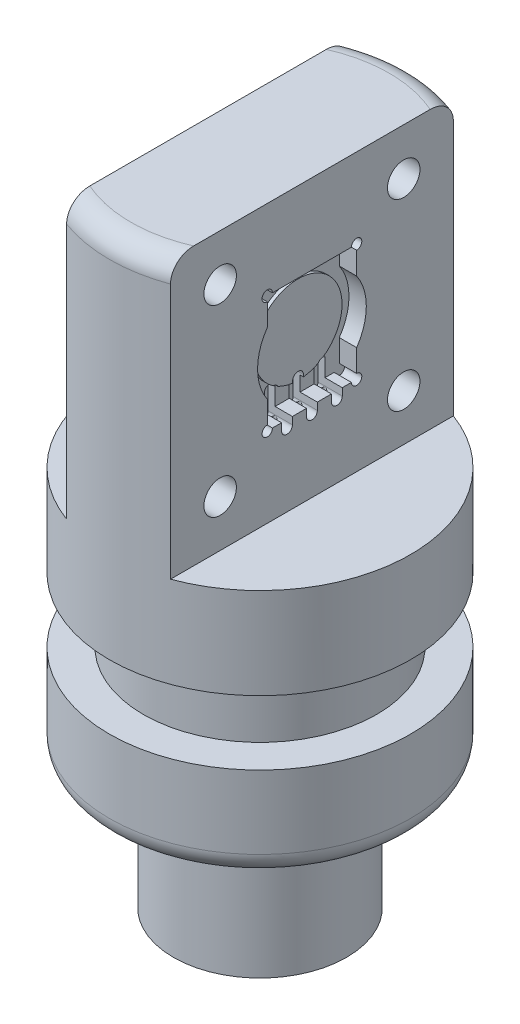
SolidWorks part; units mm, degrees
ref_plane "Front Plane" through (0, 0, 0) normal (0, 0, 1) x (1, 0, 0)
ref_plane "Top Plane" through (0, 0, 0) normal (0, 1, 0) x (1, 0, 0)
ref_plane "Right Plane" through (0, 0, 0) normal (1, 0, 0) x (0, 0, -1)
sketch "Sketch1" plane through (0, 0, 0) normal (0, 0, 1) x (1, 0, 0)
  line L0 (0, 0) -> (0, -33.5067) construction
  line L1 (0, 0) -> (0, 24.13)
  line L2 (0, 24.13) -> (5.5245, 24.13)
  line L3 (5.5245, 24.13) -> (5.5245, 10.6299)
  line L4 (4.7117, 4.7752) -> (2.6162, 4.7752)
  line L5 (2.6162, 4.7752) -> (2.6162, 3.8862)
  line L6 (2.6162, 3.8862) -> (3.175, 3.8862)
  line L7 (3.175, 3.8862) -> (3.175, 0)
  line L8 (3.175, 0) -> (0, 0)
  line L9 (5.5245, 8.2677) -> (5.5245, 5.588)
  line L10 (5.5245, 8.2677) -> (4.2799, 8.2677)
  line L12 (5.5245, 10.6299) -> (4.2799, 10.6299)
  line L13 (4.2799, 8.2677) -> (4.2799, 10.6299)
  arc A0 (5.5245, 5.588) -> (4.7117, 4.7752) centre (4.7117, 5.588) cw
  dimension "D10" = 0.8128
  dimension "D1" = 5.2324
  dimension "D2" = 6.35
  dimension "D3" = 11.049
  dimension "D4" = 4.7752
  dimension "D5" = 0.889
  dimension "D6" = 24.13
  dimension "D7" = 8.5598
  dimension "D8" = 2.3622
  dimension "D9" = 3.4925
revolve "Revolve1" add sketch "Sketch1" angle 360 about L0
fillet "Fillet1" radius 0.7874 1 edges at (0, 24.13, 5.5245)
sketch "Sketch2" plane through (0, 0, 0) normal (0, 0, 1) x (1, 0, 0)
  line L0 (5.5245, 24.13) -> (-5.5245, 24.13) construction
  line L2 (6.6159, 24.13) -> (6.6159, 13.97)
  line L3 (1.905, 24.13) -> (1.905, 13.97)
  line L4 (1.905, 13.97) -> (6.6159, 13.97)
  line L5 (1.905, 24.13) -> (6.6159, 24.13)
  dimension "D1" = 10.16
  dimension "D3" = 1.905
extrude "Flat for chip" cut sketch "Sketch2" against normal through all and the other way through all
mirror "Mirrored flat" about plane through (0, 0, 0) normal (1, 0, 0) of "Flat for chip"
sketch "Sketch3" plane through (1.905, 0, 0) normal (1, 0, 0) x (0, 0, -1)
  line L0 (-1.6383, 19.05) -> (-3.2391, 19.05) construction
  line L1 (1.6383, 21.1963) -> (-1.6383, 21.1963)
  line L2 (1.6383, 21.1963) -> (1.6383, 16.9037)
  line L3 (1.6383, 16.9037) -> (-1.6383, 16.9037)
  line L4 (-1.6383, 21.1963) -> (-1.6383, 16.9037)
  line L6 (0, 16.9037) -> (0, 0) construction
  line L9 (-1.6383, 21.1963) -> (-1.6383, 24.13) construction
  line L10 (4.3372, 24.13) -> (-4.3372, 24.13) construction
  line L11 (-1.6383, 16.9037) -> (-1.6383, 13.97) construction
  line L12 (5.1857, 13.97) -> (-5.1857, 13.97) construction
  dimension "D1" = 4.2926
  dimension "D2" = 3.2766
extrude "Chip Pocket" cut sketch "Sketch3" against normal blind 0.508
sketch "Sketch6" plane through (1.905, 0, 0) normal (1, 0, 0) x (0, 0, -1)
  circle A0 centre (-1.6383, 16.9037) radius 0.1905
  circle A1 centre (-1.6383, 21.1963) radius 0.1905
  circle A2 centre (1.6383, 21.1963) radius 0.1905
  circle A3 centre (1.6383, 16.9037) radius 0.1905
  dimension "D1" = 0.381
extrude "Corner Holes" cut sketch "Sketch6" against normal blind 0.635
sketch "Sketch5" plane through (1.905, 0, 0) normal (1, 0, 0) x (0, 0, -1)
  line L0 (-1.6383, 16.9037) -> (1.6383, 21.1963) construction
  line L2 (-1.4478, 16.9037) -> (1.4478, 16.9037) construction
  line L5 (-1.6383, 21.1963) -> (-1.6383, 20.1865)
  line L6 (-1.6383, 16.9037) -> (1.6383, 16.9037)
  line L7 (1.6383, 16.9037) -> (1.6383, 17.9135)
  line L8 (1.6383, 21.1963) -> (-1.6383, 21.1963)
  line L9 (1.6383, 20.1865) -> (1.6383, 21.1963)
  line L10 (-1.6383, 17.9135) -> (-1.6383, 16.9037)
  line L11 (1.4478, 21.1963) -> (-1.4478, 21.1963) construction
  circle A0 centre (0, 19.05) radius 1.6129
  arc A1 (-1.6383, 20.1865) -> (-1.6383, 17.9135) centre (0, 19.05) ccw
  arc A6 (1.6383, 17.9135) -> (1.6383, 20.1865) centre (0, 19.05) ccw
  dimension "D2" = 3.2258
  dimension "D3" = 0.381
extrude "Pedestal" cut sketch "Sketch5" against normal blind 0.635
sketch "Sketch7" plane through (1.905, 0, 0) normal (1, 0, 0) x (0, 0, -1)
  line L0 (-0.9144, 16.637) -> (-0.9144, 17.526) construction
  line L1 (-1.1125, 16.637) -> (-1.1125, 17.526)
  line L2 (-0.7163, 16.637) -> (-0.7163, 17.526)
  line L3 (0, 16.637) -> (0, 17.526) construction
  line L4 (-0.1981, 16.637) -> (-0.1981, 17.526)
  line L5 (0.1981, 16.637) -> (0.1981, 17.526)
  line L6 (0.9144, 16.637) -> (0.9144, 17.526) construction
  line L7 (0.7163, 16.637) -> (0.7163, 17.526)
  line L8 (1.1125, 16.637) -> (1.1125, 17.526)
  line L9 (0, 16.637) -> (0.9144, 16.637) construction
  line L10 (1.6383, 21.1963) -> (-1.6383, 16.9037) construction
  line L11 (-0.9144, 16.637) -> (0, 16.637) construction
  line L13 (1.1833, 19.05) -> (0, 19.05) construction
  line L15 (0, 19.05) -> (0, 21.1963) construction
  line L16 (1.4478, 21.1963) -> (-1.4478, 21.1963) construction
  arc A0 (-1.1125, 16.637) -> (-0.7163, 16.637) centre (-0.9144, 16.637) ccw
  arc A1 (-0.7163, 17.526) -> (-1.1125, 17.526) centre (-0.9144, 17.526) ccw
  arc A2 (-0.1981, 16.637) -> (0.1981, 16.637) centre (0, 16.637) ccw
  arc A3 (0.1981, 17.526) -> (-0.1981, 17.526) centre (0, 17.526) ccw
  arc A4 (0.7163, 16.637) -> (1.1125, 16.637) centre (0.9144, 16.637) ccw
  arc A5 (1.1125, 17.526) -> (0.7163, 17.526) centre (0.9144, 17.526) ccw
  circle A7 centre (-1.6383, 16.9037) radius 0.1905 construction
  point P2 (-0.9144, 17.0815)
  point P7 (0, 17.0815)
  point P14 (0.9144, 17.0815)
  dimension "D4" = 2.413
  dimension "D1" = 0.9144
  dimension "D2" = 0.3962
  dimension "D3" = 1.524
extrude "Slots" cut sketch "Sketch7" against normal blind 0.889
ref_plane "Plane1" through (5.6556, 15.5386, 0) normal (0.342, 0.9397, 0) x (0, 0, -1)
sketch "Sketch8" plane through (5.6556, 15.5386, 0) normal (0.342, 0.9397, 0) x (0, 0, -1)
  line L0 (-0.9144, 3.8323) -> (-0.9144, 4.4696) construction
  line L1 (0, 4.4696) -> (0, 3.8323) construction
  line L2 (0.9144, 4.4696) -> (0.9144, 3.8323) construction
  line L8 (0.9144, 4.4696) -> (0.9144, 4.6677) construction
  circle A0 centre (0, 4.4696) radius 0.1981
  circle A1 centre (0.9144, 4.4696) radius 0.1981
  circle A2 centre (-0.9144, 4.4696) radius 0.1981
  ellipse E0 centre (-0.9144, 3.9001) end of major axis (-1.1125, 3.9001) minor radius 0.0678 (-1.1125, 3.9001) -> (-0.7163, 3.9001) ccw construction
  ellipse E1 centre (0, 3.9001) end of major axis (-0.1981, 3.9001) minor radius 0.0678 (-0.1981, 3.9001) -> (0.1981, 3.9001) ccw construction
  ellipse E2 centre (0.9144, 3.9001) end of major axis (0.7163, 3.9001) minor radius 0.0678 (0.7163, 3.9001) -> (1.1125, 3.9001) ccw construction
  ellipse E4 centre (0.9144, 4.7355) end of major axis (0.7163, 4.7355) minor radius 0.0678 (0.7163, 4.7355) -> (1.1125, 4.7355) ccw construction
  dimension "D1" = 0.3962
extrude "Angled Wire Holes" cut sketch "Sketch8" against normal blind 4.318
sketch "Sketch9" plane through (0, 0, 0) normal (0, 0, 1) x (1, 0, 0)
  line L0 (0, 0) -> (0, -2.6583) construction
  line L1 (1.905, 16.9037) -> (1.27, 16.9037) construction
  line L2 (0, 0) -> (1.3843, 0)
  line L3 (0, 0) -> (0, 13.7729)
  line L4 (0, 13.7729) -> (1.1303, 13.0937)
  line L5 (1.1303, 7.7726) -> (1.1303, 13.0937)
  line L6 (1.1303, 7.7726) -> (1.3843, 7.62)
  line L7 (1.3843, 7.62) -> (1.3843, 0)
  line L8 (-3.175, 0) -> (3.175, 0) construction
  dimension "D1" = 59
  dimension "D2" = 3.81
  dimension "D3" = 2.2606
  dimension "D4" = 2.7686
  dimension "D5" = 7.62
revolve "CenterHole" cut sketch "Sketch9" angle 360 about L0
sketch "Sketch10" plane through (1.905, 0, 0) normal (1, 0, 0) x (0, 0, -1)
  line L0 (-1.6383, 16.9037) -> (1.6383, 21.1963) construction
  line L2 (3.3655, 15.6845) -> (-3.3655, 15.6845) construction
  line L3 (3.3655, 15.6845) -> (3.3655, 22.4155) construction
  line L4 (3.3655, 22.4155) -> (-3.3655, 22.4155) construction
  line L5 (-3.3655, 15.6845) -> (-3.3655, 22.4155) construction
  line L6 (3.3655, 15.6845) -> (-3.3655, 22.4155) construction
  line L7 (3.3655, 22.4155) -> (-3.3655, 15.6845) construction
  circle A0 centre (-3.3655, 22.4155) radius 0.5956
  circle A1 centre (3.3655, 22.4155) radius 0.5956
  circle A2 centre (-3.3655, 15.6845) radius 0.5956
  circle A3 centre (3.3655, 15.6845) radius 0.5956
  point P4 (0, 19.05)
  dimension "D2" = 1.1913
  dimension "D1" = 6.731
extrude "Screw holes" cut sketch "Sketch10" against normal blind 5.08
sketch "Sketch11" [suppressed] plane through (1.905, 0, 0) normal (1, 0, 0) x (0, 0, -1)
  line L0 (-1.6256, 18.1864) -> (1.6256, 22.4536) construction
  circle A0 centre (0, 20.32) radius 3.1496
  arc A1 (1.3716, 18.1864) -> (1.6256, 18.4404) centre (1.6256, 18.1864) ccw construction
  arc A2 (0.6096, 17.907) -> (1.2192, 17.907) centre (0.9144, 17.907) ccw construction
  dimension "D1" = 6.2992
  dimension "D2" = 0.2133
  dimension "D3" = 0.2644
